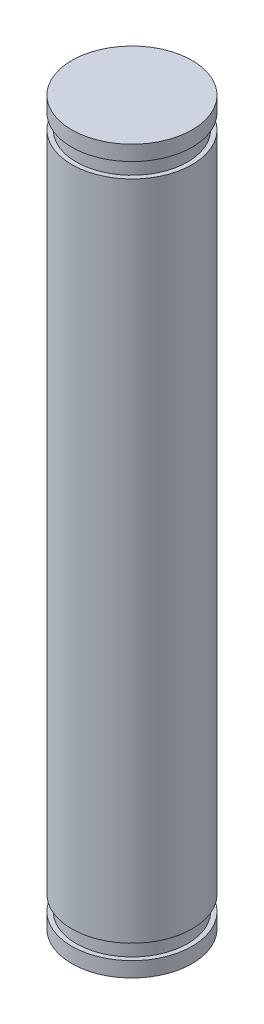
SolidWorks part; units mm, degrees
ref_plane "Спереди" through (0, 0, 0) normal (0, 0, 1) x (1, 0, 0)
ref_plane "Сверху" through (0, 0, 0) normal (0, 1, 0) x (1, 0, 0)
ref_plane "Справа" through (0, 0, 0) normal (1, 0, 0) x (0, 0, -1)
sketch "Эскиз1" plane through (0, 0, 0) normal (0, 1, 0) x (1, 0, 0)
  circle A0 centre (0, 0) radius 4
  dimension "D1" = 8
extrude "Бобышка-Вытянуть1" add sketch "Эскиз1" along normal blind 1
sketch "Эскиз2" plane through (0, 1, 0) normal (0, 1, 0) x (1, 0, 0)
  circle A0 centre (0, 0) radius 3.7
  dimension "D1" = 7.4
extrude "Бобышка-Вытянуть2" add sketch "Эскиз2" along normal blind 1
sketch "Эскиз3" plane through (0, 2, 0) normal (0, 1, 0) x (1, 0, 0)
  circle A0 centre (0, 0) radius 4
extrude "Бобышка-Вытянуть3" add sketch "Эскиз3" along normal blind 44
sketch "Эскиз4" plane through (0, 46, 0) normal (0, 1, 0) x (1, 0, 0)
  circle A0 centre (0, 0) radius 3.7
extrude "Бобышка-Вытянуть4" add sketch "Эскиз4" along normal blind 1
sketch "Эскиз5" plane through (0, 47, 0) normal (0, 1, 0) x (1, 0, 0)
  circle A0 centre (0, 0) radius 4
extrude "Бобышка-Вытянуть5" add sketch "Эскиз5" along normal blind 1
